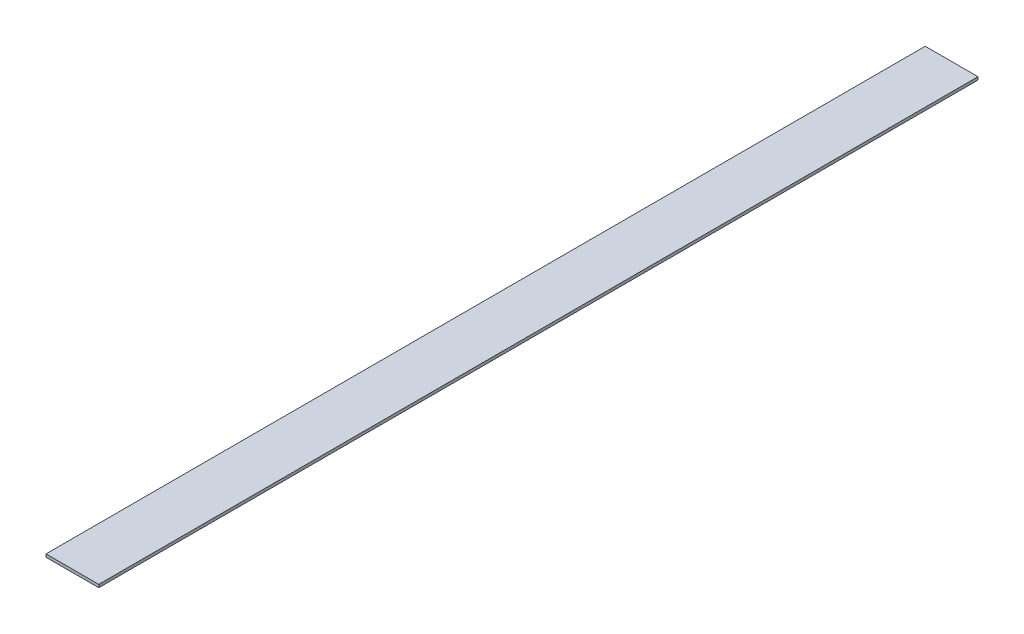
SolidWorks part; units mm, degrees
ref_plane "Face" through (0, 0, 0) normal (0, 0, 1) x (1, 0, 0)
ref_plane "Dessus" through (0, 0, 0) normal (0, 1, 0) x (1, 0, 0)
ref_plane "Droite" through (0, 0, 0) normal (1, 0, 0) x (0, 0, -1)
sketch "Esquisse1" plane through (0, 0, 0) normal (0, 0, 1) x (1, 0, 0)
  line L1 (0, 0) -> (90, 0)
  line L2 (0, 0) -> (0, -5)
  line L3 (0, -5) -> (90, -5)
  line L4 (90, 0) -> (90, -5)
  dimension "D1" = 90
  dimension "D2" = 5
extrude "Base-Extrusion" add sketch "Esquisse1" along normal blind 1500
